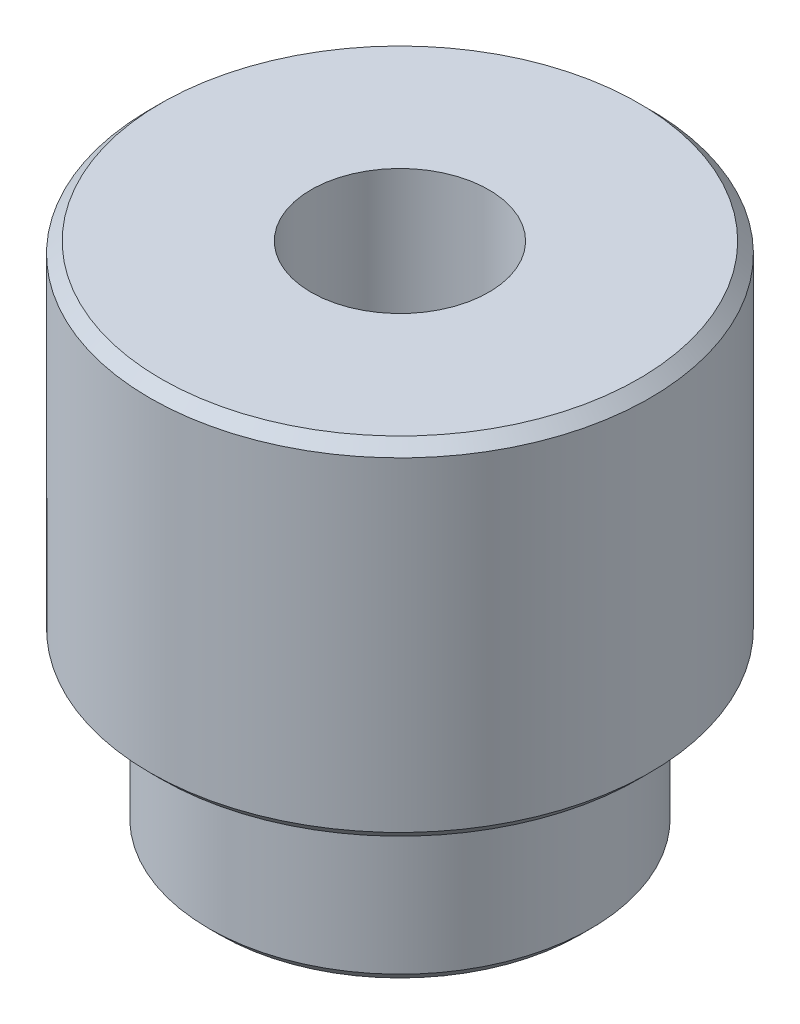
SolidWorks part; units mm, degrees
ref_plane "Front Plane" through (0, 0, 0) normal (0, 0, 1) x (1, 0, 0)
ref_plane "Top Plane" through (0, 0, 0) normal (0, 1, 0) x (1, 0, 0)
ref_plane "Right Plane" through (0, 0, 0) normal (1, 0, 0) x (0, 0, -1)
sketch "Sketch1" plane through (0, 0, 0) normal (0, 1, 0) x (1, 0, 0)
  circle A0 centre (0, 0) radius 2.25
  dimension "D1" = 4.5
extrude "Boss-Extrude1" add sketch "Sketch1" against normal blind 3.12
sketch "Sketch2" plane through (0, -3.12, 0) normal (0, -1, 0) x (1, 0, 0)
  circle A0 centre (0, 0) radius 1.72
  dimension "D1" = 3.44
extrude "Boss-Extrude2" add sketch "Sketch2" along normal blind 1.48
hole_wizard "Tap Drill for M2 Tap1" positions "Sketch3" profile "Sketch4" hole size "M2" standard "ISO"
sketch "Sketch3" plane through (0, 0, 0) normal (0, 1, 0) x (1, 0, 0)
  point P0 (0, 0)
sketch "Sketch4" plane through (0, 0, 0) normal (1, 0, 0) x (0, 0, 1)
  line L0 (0, 0) -> (0, 4.6)
  line L1 (0, 4.6) -> (0.8, 4.6)
  line L2 (0.8, 4.6) -> (0.8, 0)
  line L5 (0.8, 0) -> (0, 0)
  line L11 (0, -6.35) -> (0, 107.95) construction
  dimension "Thru Hole Dia." = 1.6
  dimension "Thru Hole Depth" = 4.6
chamfer "Chamfer1" distance 0.1 angle 45 3 edges at (0, -4.6, -1.72) (0, -3.12, 2.25) (0, 0, 2.25)
